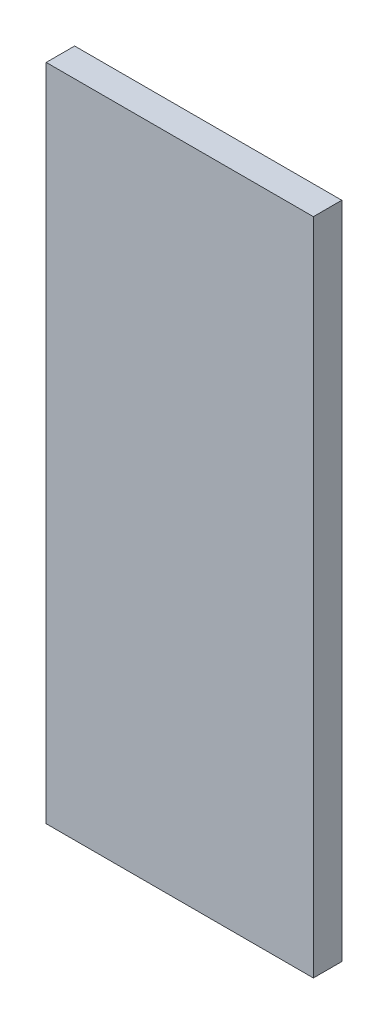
SolidWorks part; units mm, degrees
ref_plane "Front Plane" through (0, 0, 0) normal (0, 0, 1) x (1, 0, 0)
ref_plane "Top Plane" through (0, 0, 0) normal (0, 1, 0) x (1, 0, 0)
ref_plane "Right Plane" through (0, 0, 0) normal (1, 0, 0) x (0, 0, -1)
sketch "Sketch1" plane through (0, 0, 0) normal (0, 0, 1) x (1, 0, 0)
  line L1 (-47, -1154) -> (0, -1154)
  line L2 (-47, -1154) -> (-47, -1270)
  line L3 (-47, -1270) -> (0, -1270)
  line L4 (0, -1154) -> (0, -1270)
  line L5 (-47, -1154) -> (0, -1270) construction
  line L6 (-47, -1270) -> (0, -1154) construction
  point P0 (-23.5, -1212)
  dimension "D1" = 116
  dimension "D2" = 47
extrude "Boss-Extrude1" add sketch "Sketch1" along normal blind 5
